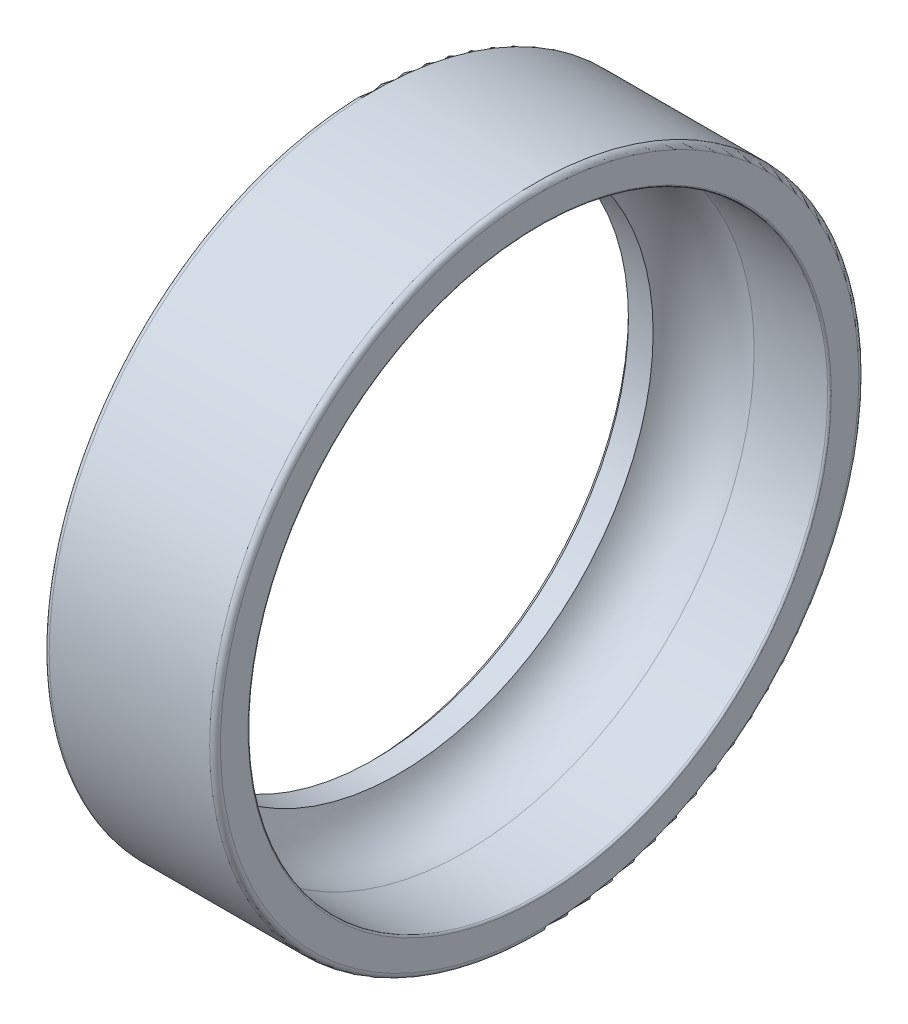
SolidWorks part; units mm, degrees
ref_plane "Alzado" through (0, 0, 0) normal (0, 0, 1) x (1, 0, 0)
ref_plane "Planta" through (0, 0, 0) normal (0, 1, 0) x (1, 0, 0)
ref_plane "Vista lateral" through (0, 0, 0) normal (1, 0, 0) x (0, 0, -1)
ref_plane "Plano1" through (0, 0, 0) normal (0, 0, 1) x (1, 0, 0)
sketch "Croquis1" plane through (0, 0, 0) normal (0, 0, 1) x (1, 0, 0)
  line L0 (0, 35.4) -> (0, 28.85)
  line L1 (0, 28.85) -> (0.6, 28.25)
  line L2 (0.6, 28.25) -> (3.3389, 28.25)
  line L3 (10.64, 32.15) -> (18.8, 32.15)
  line L4 (19, 32.35) -> (19, 35.4)
  line L5 (18.4, 36) -> (0.6, 36)
  line L6 (19, 0) -> (0, 0) construction
  arc A0 (3.3389, 28.25) -> (10.64, 32.15) centre (9.5, 25.5) cw
  arc A1 (18.8, 32.15) -> (19, 32.35) centre (18.8, 32.35) ccw
  arc A2 (19, 35.4) -> (18.4, 36) centre (18.4, 35.4) ccw
  arc A3 (0.6, 36) -> (0, 35.4) centre (0.6, 35.4) ccw
revolve "Revolución1" add sketch "Croquis1" angle 360 about L6
